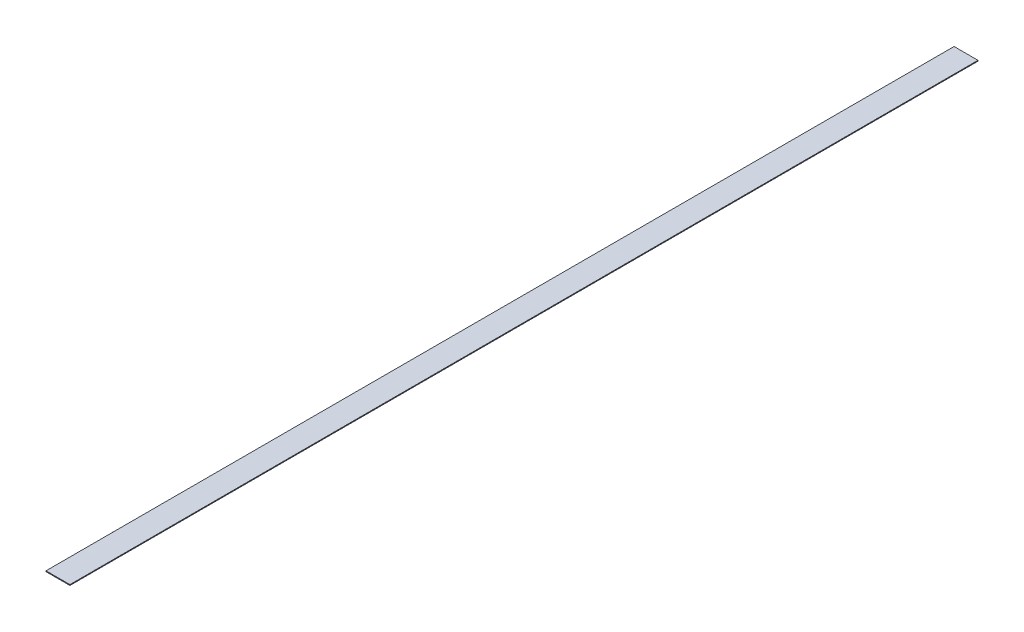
SolidWorks part; units mm, degrees
ref_plane "Face" through (0, 0, 0) normal (0, 0, 1) x (1, 0, 0)
ref_plane "Dessus" through (0, 0, 0) normal (0, 1, 0) x (1, 0, 0)
ref_plane "Droite" through (0, 0, 0) normal (1, 0, 0) x (0, 0, -1)
sketch "Esquisse1" plane through (0, 0, 0) normal (0, 1, 0) x (1, 0, 0)
  line L1 (0, 0) -> (15, 0)
  line L2 (0, 0) -> (0, 570)
  line L3 (0, 570) -> (15, 570)
  line L4 (15, 0) -> (15, 570)
  dimension "D1" = 15
  dimension "D2" = 570
extrude "Extrusion1" add sketch "Esquisse1" along normal blind 0.5
